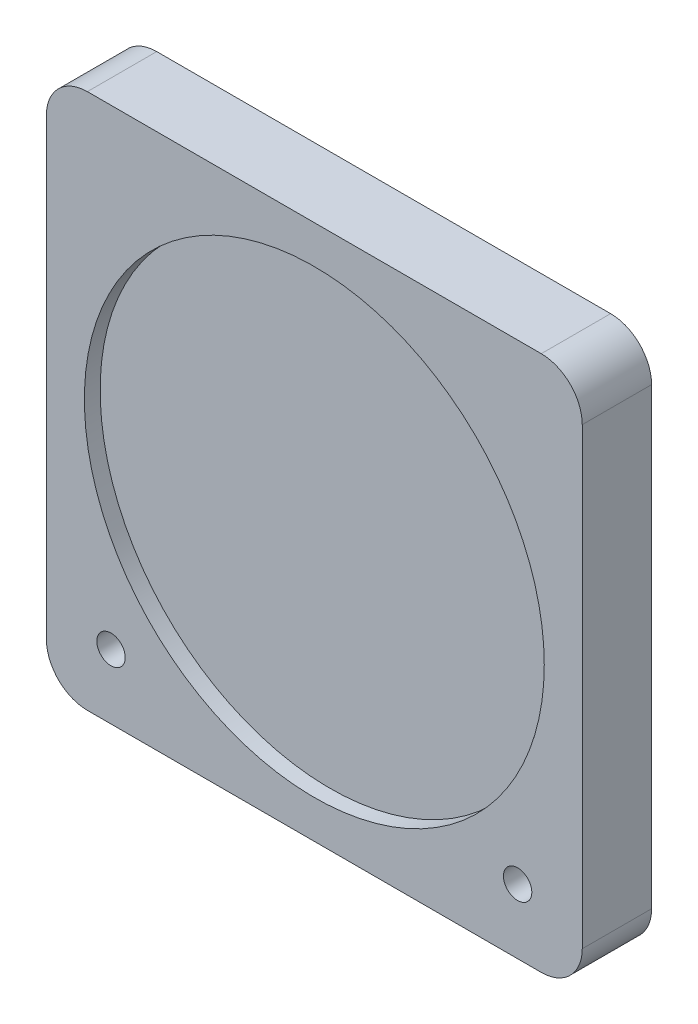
SolidWorks part; units mm, degrees
ref_plane "Plan de face" through (0, 0, 0) normal (0, 0, 1) x (1, 0, 0)
ref_plane "Plan de dessus" through (0, 0, 0) normal (0, 1, 0) x (1, 0, 0)
ref_plane "Plan de droite" through (0, 0, 0) normal (1, 0, 0) x (0, 0, -1)
sketch "Esquisse1" plane through (0, 0, 0) normal (0, 0, 1) x (1, 0, 0)
  line L1 (0, 0) -> (170, 0)
  line L2 (0, 0) -> (0, 170)
  line L3 (0, 170) -> (170, 170)
  line L4 (170, 0) -> (170, 170)
  dimension "D1" = 170
  dimension "D2" = 170
extrude "Extrusion1" add sketch "Esquisse1" along normal blind 22
fillet "Congé1" radius 13 4 edges at (0, 0, 11) (170, 0, 11) (0, 170, 11) (170, 170, 11)
hole_wizard "Dégagement M81" positions "Esquisse3" profile "Esquisse2" hole size "M8" standard "ISO"
sketch "Esquisse3" plane through (0, 0, 22) normal (0, 0, 1) x (1, 0, 0)
  line L0 (170, 13) -> (170, 157) construction
  line L1 (13, 0) -> (157, 0) construction
  point P0 (149.5, 20.5)
  dimension "D1" = 20.5
  dimension "D2" = 20.5
sketch "Esquisse2" plane through (149.5, 20.5, 22) normal (1, 0, 0) x (0, -1, 0)
  line L0 (0, 0) -> (0, 22)
  line L1 (0, 22) -> (4.5, 22)
  line L2 (4.5, 22) -> (4.5, 0)
  line L5 (4.5, 0) -> (0, 0)
  line L11 (0, -6.35) -> (0, 107.95) construction
  dimension "Diamètre du perçage jusqu'au prochain" = 9
  dimension "Profondeur du perçage jusqu'au prochain" = 22
pattern_linear "Répétition linéaire1" count 2 spacing 129 along (-1, 0, 0) of "Dégagement M81"
sketch "Esquisse4" plane through (0, 0, 22) normal (0, 0, 1) x (1, 0, 0)
  line L0 (170, 13) -> (170, 157) construction
  line L1 (157, 170) -> (13, 170) construction
  circle A0 centre (85, 85) radius 72.95
  dimension "D1" = 145.9
  dimension "D2" = 85
  dimension "D3" = 85
extrude "Enlèv. mat.-Extru.1" cut sketch "Esquisse4" against normal blind 5
